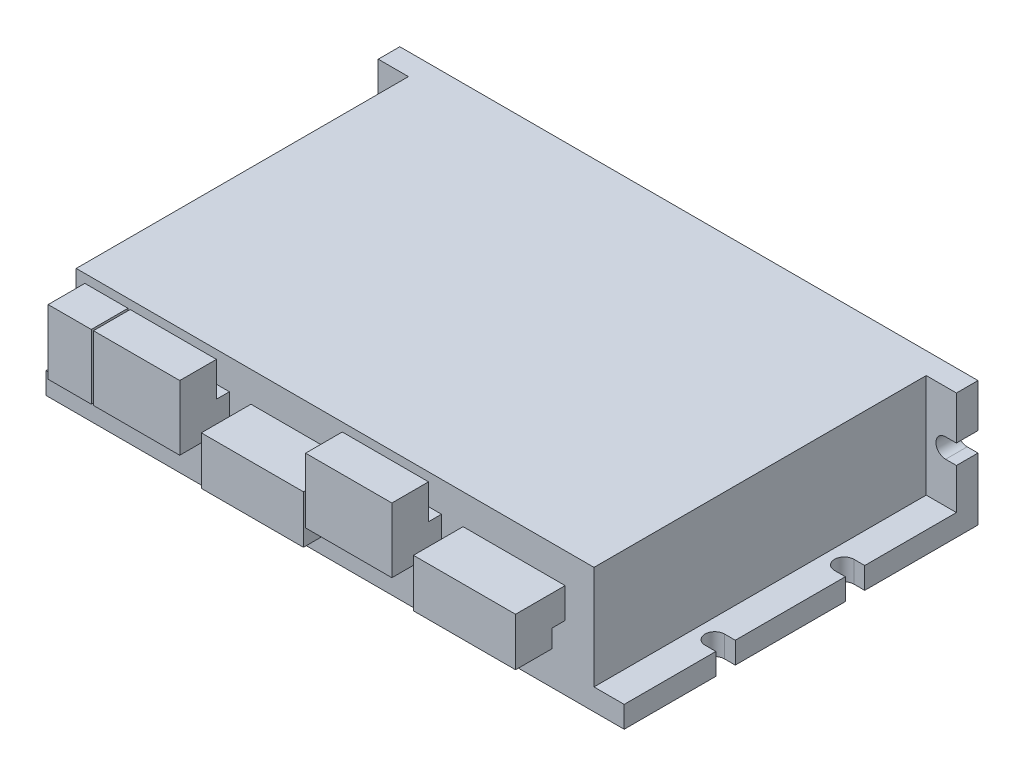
SolidWorks part; units mm, degrees
ref_plane "前视" through (0, 0, 0) normal (0, 0, 1) x (1, 0, 0)
ref_plane "上视" through (0, 0, 0) normal (0, 1, 0) x (1, 0, 0)
ref_plane "右视" through (0, 0, 0) normal (1, 0, 0) x (0, 0, -1)
sketch "草图1" plane through (0, 0, 0) normal (0, 1, 0) x (1, 0, 0)
  line L1 (0, 0) -> (134, 0)
  line L2 (0, 0) -> (0, 82)
  line L3 (0, 82) -> (134, 82)
  line L4 (134, 0) -> (134, 82)
extrude "凸台-拉伸1" add sketch "草图1" along normal blind 29
sketch "草图2" plane through (0, 0, 0) normal (0, 0, 1) x (1, 0, 0)
  line L1 (0, 29) -> (7, 29)
  line L2 (0, 29) -> (0, 5)
  line L3 (0, 5) -> (7, 5)
  line L4 (7, 29) -> (7, 5)
  line L5 (134, 29) -> (127, 29)
  line L6 (134, 29) -> (134, 5)
  line L7 (134, 5) -> (127, 5)
  line L8 (127, 29) -> (127, 5)
extrude "切除-拉伸1" cut sketch "草图2" against normal blind 77
sketch "草图3" plane through (0, 0, 0) normal (0, 1, 0) x (1, 0, 0)
  line L0 (0, 77) -> (0, 0) construction
  line L2 (2.5, 25.75) -> (0, 25.75)
  line L3 (134, 77) -> (134, 0) construction
  line L4 (2.5, 21.25) -> (0, 21.25)
  line L5 (0, 25.75) -> (0, 21.25)
  line L6 (131.5, 55.75) -> (134, 55.75)
  line L7 (2.5, 55.75) -> (0, 55.75)
  line L9 (2.5, 51.25) -> (0, 51.25)
  line L10 (0, 55.75) -> (0, 51.25)
  line L11 (131.5, 51.25) -> (134, 51.25)
  line L12 (134, 55.75) -> (134, 51.25)
  line L14 (131.5, 25.75) -> (134, 25.75)
  line L16 (131.5, 21.25) -> (134, 21.25)
  line L17 (134, 25.75) -> (134, 21.25)
  arc A0 (2.5, 25.75) -> (2.5, 21.25) centre (2.5, 23.5) cw
  arc A1 (2.5, 55.75) -> (2.5, 51.25) centre (2.5, 53.5) cw
  arc A2 (131.5, 55.75) -> (131.5, 51.25) centre (131.5, 53.5) ccw
  arc A3 (131.5, 25.75) -> (131.5, 21.25) centre (131.5, 23.5) ccw
  dimension "D1" = 2.25
  dimension "D2" = 2.25
  dimension "D3" = 2.25
  dimension "D4" = 2.25
extrude "切除-拉伸7" cut sketch "草图3" along normal blind 5
ref_plane "基准面1" through (0, 0, -77) normal (0, 0, 1) x (1, 0, 0)
sketch "草图4" plane through (0, 0, -77) normal (0, 0, 1) x (1, 0, 0)
  line L0 (0, 29) -> (0, 5) construction
  line L1 (2.5, 18.95) -> (0, 18.95)
  line L2 (134, 5) -> (134, 29) construction
  line L3 (2.5, 14.45) -> (0, 14.45)
  line L4 (0, 18.95) -> (0, 14.45)
  line L5 (131.5, 18.95) -> (134, 18.95)
  line L7 (131.5, 14.45) -> (134, 14.45)
  line L8 (134, 18.95) -> (134, 14.45)
  arc A0 (2.5, 18.95) -> (2.5, 14.45) centre (2.5, 16.7) cw
  arc A1 (131.5, 18.95) -> (131.5, 14.45) centre (131.5, 16.7) ccw
  dimension "D1" = 2.25
  dimension "D2" = 2.25
extrude "切除-拉伸8" cut sketch "草图4" against normal blind 5
sketch "草图5" plane through (0, 0, 0) normal (0, 0, 1) x (1, 0, 0)
  line L1 (12, 22) -> (22, 22)
  line L3 (22, 22) -> (22, 15)
  line L4 (22, 15) -> (12, 15)
  line L5 (12, 15) -> (12, 22)
  line L7 (47.5, 15) -> (47.5, 22)
  line L8 (22.5, 15) -> (42.5, 15)
  line L9 (22.5, 15) -> (22.5, 22)
  line L10 (96.66, 15) -> (120.32, 15)
  line L11 (22.5, 22) -> (42.5, 22)
  line L12 (96.66, 15) -> (96.66, 22)
  line L13 (96.66, 22) -> (120.32, 22)
  line L14 (42.5, 15) -> (42.5, 22)
  line L15 (120.32, 15) -> (120.32, 22)
  line L16 (47.5, 22) -> (71.16, 22)
  line L17 (71.16, 22) -> (71.16, 15)
  line L18 (71.16, 15) -> (47.5, 15)
  line L19 (71.66, 22) -> (71.66, 15)
  line L20 (71.66, 15) -> (91.66, 15)
  line L21 (91.66, 15) -> (91.66, 22)
  line L22 (91.66, 22) -> (71.66, 22)
extrude "凸台-拉伸2" add sketch "草图5" along normal blind 3
ref_plane "基准面2" through (0, 0, 3) normal (0, 0, 1) x (1, 0, 0)
sketch "草图7" plane through (0, 0, 3) normal (0, 0, 1) x (1, 0, 0)
  line L1 (12, 15) -> (22, 15)
  line L2 (12, 15) -> (12, 30)
  line L3 (12, 30) -> (22, 30)
  line L4 (22, 15) -> (22, 30)
  line L5 (22.5, 15) -> (42.5, 15)
  line L6 (22.5, 15) -> (22.5, 30)
  line L7 (22.5, 30) -> (42.5, 30)
  line L8 (42.5, 15) -> (42.5, 30)
  line L9 (71.66, 15) -> (91.66, 15)
  line L10 (71.66, 15) -> (71.66, 30)
  line L11 (71.66, 30) -> (91.66, 30)
  line L12 (91.66, 15) -> (91.66, 30)
  line L13 (47.5, 22) -> (71.16, 22)
  line L14 (47.5, 22) -> (47.5, 10.85)
  line L15 (47.5, 10.85) -> (71.16, 10.85)
  line L16 (71.16, 22) -> (71.16, 10.85)
  line L17 (96.66, 22) -> (120.32, 22)
  line L18 (96.66, 22) -> (96.66, 10.85)
  line L19 (96.66, 10.85) -> (120.32, 10.85)
  line L20 (120.32, 22) -> (120.32, 10.85)
extrude "凸台-拉伸3" add sketch "草图7" along normal blind 8.5
